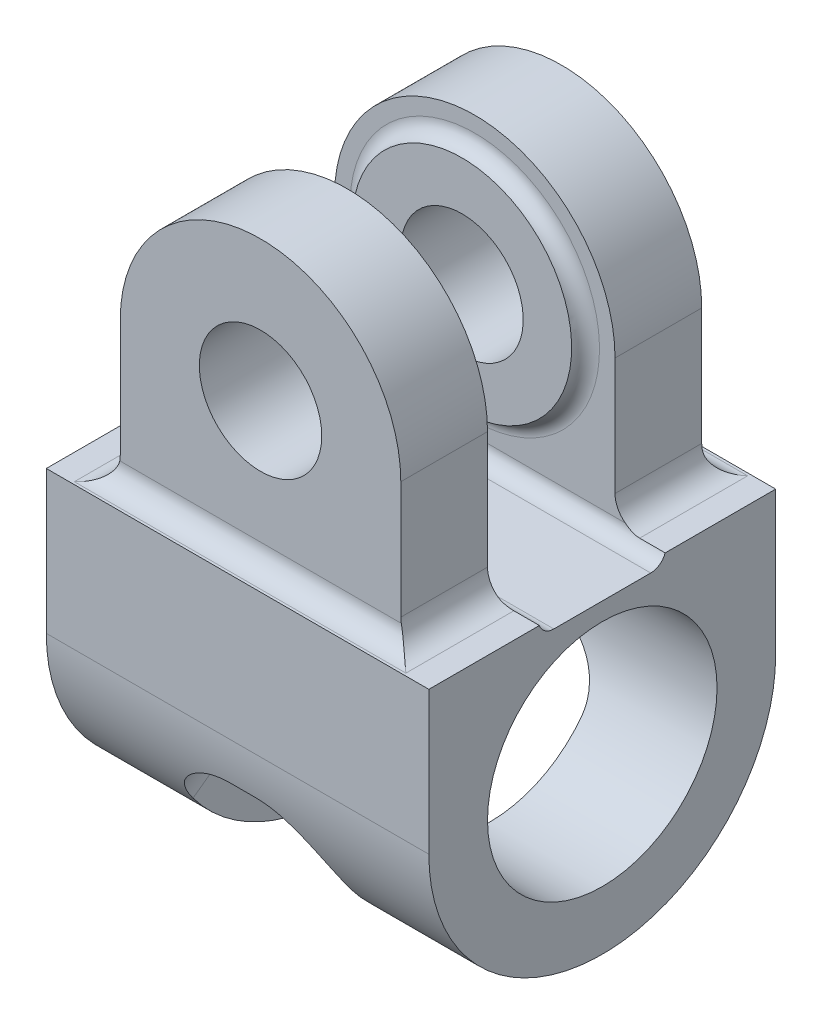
SolidWorks part; units mm, degrees
ref_plane "Plan de face" through (0, 0, 0) normal (0, 0, 1) x (1, 0, 0)
ref_plane "Plan de dessus" through (0, 0, 0) normal (0, 1, 0) x (1, 0, 0)
ref_plane "Plan de droite" through (0, 0, 0) normal (1, 0, 0) x (0, 0, -1)
sketch "Esquisse1" plane through (0, 0, 0) normal (0, 0, 1) x (1, 0, 0)
  line L0 (-27.5, 0) -> (-27.5, -23)
  line L1 (0, 63.884) -> (0, -128.9245) construction
  line L2 (-32.5, -28) -> (-37.5, -28)
  line L3 (-37.5, -28) -> (-37.5, -90)
  line L4 (-37.5, -90) -> (37.5, -90)
  line L5 (37.5, -28) -> (37.5, -90)
  line L6 (32.5, -28) -> (37.5, -28)
  line L7 (27.5, 0) -> (27.5, -23)
  circle A0 centre (0, 0) radius 12
  arc A1 (-27.5, 0) -> (27.5, 0) centre (0, 0) cw
  arc A2 (-27.5, -23) -> (-32.5, -28) centre (-32.5, -23) cw
  arc A3 (27.5, -23) -> (32.5, -28) centre (32.5, -23) ccw
  point P15 (-27.5, -28)
  point P18 (0, -90)
  point P19 (27.5, -28)
  dimension "D1" = 24
  dimension "D4" = 27.5
  dimension "D7" = 5
  dimension "D2" = 28
  dimension "D3" = 10
  dimension "D5" = 75
extrude "Extrusion1" add sketch "Esquisse1" along normal blind 80
sketch "Esquisse2" plane through (37.5, 0, 0) normal (1, 0, 0) x (0, 0, -1)
  line L0 (0, 27.5) -> (-80, 27.5) construction
  line L1 (-111.7296, -56) -> (36.2394, -56) construction
  line L2 (-69.6873, 27.5) -> (-69.6873, -24)
  line L3 (-80, -28) -> (0, -28) construction
  line L4 (-73.6873, -28) -> (-74.1873, -28)
  line L5 (-74.1873, -28) -> (-74.1873, -56)
  line L6 (-27.6873, 27.5) -> (-10.6873, 27.5)
  line L7 (-52.6873, 27.5) -> (-52.6873, -27)
  line L8 (-49.6873, -30) -> (-30.6873, -30)
  line L9 (-27.6873, 27.5) -> (-27.6873, -27)
  line L10 (-40.1873, 27.5) -> (-40.1873, -106.6234) construction
  line L11 (-52.6873, 27.5) -> (-69.6873, 27.5)
  line L12 (-6.1873, -28) -> (-6.1873, -56)
  line L13 (-6.6873, -28) -> (-6.1873, -28)
  line L14 (-86.1202, 0) -> (6.9767, 0) construction
  line L15 (-10.6873, 27.5) -> (-10.6873, -24)
  arc A0 (-69.6873, -24) -> (-73.6873, -28) centre (-73.6873, -24) cw
  arc A1 (-52.6873, -27) -> (-49.6873, -30) centre (-49.6873, -27) ccw
  arc A2 (-74.1873, -56) -> (-6.1873, -56) centre (-40.1873, -56) ccw
  circle A3 centre (-40.1873, -56) radius 22.5
  arc A4 (-27.6873, -27) -> (-30.6873, -30) centre (-30.6873, -27) cw
  arc A5 (-10.6873, -24) -> (-6.6873, -28) centre (-6.6873, -24) ccw
  point P18 (-69.6873, -28)
  point P21 (-52.6873, -30)
  point P35 (-40.1873, -30)
  point P36 (-27.6873, -30)
  point P37 (-10.6873, -28)
  dimension "D4" = 4
  dimension "D5" = 3
  dimension "D9" = 45
  dimension "D1" = 17
  dimension "D2" = 59
  dimension "D3" = 68
  dimension "D6" = 28
  dimension "D7" = 56
  dimension "D8" = 26
extrude "Extrusion2" cut sketch "Esquisse2" against normal blind 90 flip side to cut
sketch "Esquisse3" plane through (0, 0, 0) normal (1, 0, 0) x (0, 0, -1)
  line L0 (-40.1873, -30) -> (-40.1873, -133.9679) construction
  line L1 (-40.1873, -40.5) -> (-88.2571, -75.4247)
  line L2 (-88.2571, -75.4247) -> (-88.2571, -105.3695)
  line L3 (-88.2571, -105.3695) -> (7.8825, -105.3695)
  line L4 (-30.6873, -30) -> (-49.6873, -30) construction
  line L5 (-6.1873, -56) -> (-86.598, -56) construction
  line L6 (-40.1873, -40.5) -> (7.8825, -75.4247)
  line L7 (7.8825, -75.4247) -> (7.8825, -105.3695)
  point P12 (-40.1873, -105.3695)
  dimension "D1" = 54
  dimension "D2" = 15.5
extrude "Extrusion3" cut sketch "Esquisse3" against normal mid plane 31
fillet "Congé1" radius 13 4 edges at (15.5, -60.6334, 12.476) (-15.5, -60.6334, 12.476) (-15.5, -60.6334, 67.8986) (15.5, -60.6334, 67.8986)
sketch "Esquisse4" plane through (0, 0, 27.6873) normal (0, 0, 1) x (1, 0, 0)
  circle A0 centre (0, 0) radius 12
  circle A1 centre (0, 0) radius 21.4966
extrude "Extrusion4" add sketch "Esquisse4" along normal blind 31
sketch "Esquisse5" plane through (0, 0, 0) normal (0, 1, 0) x (1, 0, 0)
  line L1 (-26.671, -30.1873) -> (25.6112, -30.1873)
  line L2 (-26.671, -30.1873) -> (-26.671, -50.1873)
  line L4 (25.6112, -30.1873) -> (25.6112, -50.1873)
  line L6 (-37.5, -40.1873) -> (37.5, -40.1873) construction
  line L7 (-37.5, -30.6873) -> (-37.5, -49.6873) construction
  line L8 (37.5, -30.6873) -> (37.5, -49.6873) construction
  line L9 (-26.671, -50.1873) -> (25.6112, -50.1873)
  dimension "D1" = 20
extrude "Extrusion5" cut sketch "Esquisse5" against normal mid plane 51
fillet "Congé2" radius 3 2 edges at (-21.4966, 0, 52.6873) (21.4966, 0, 27.6873)
